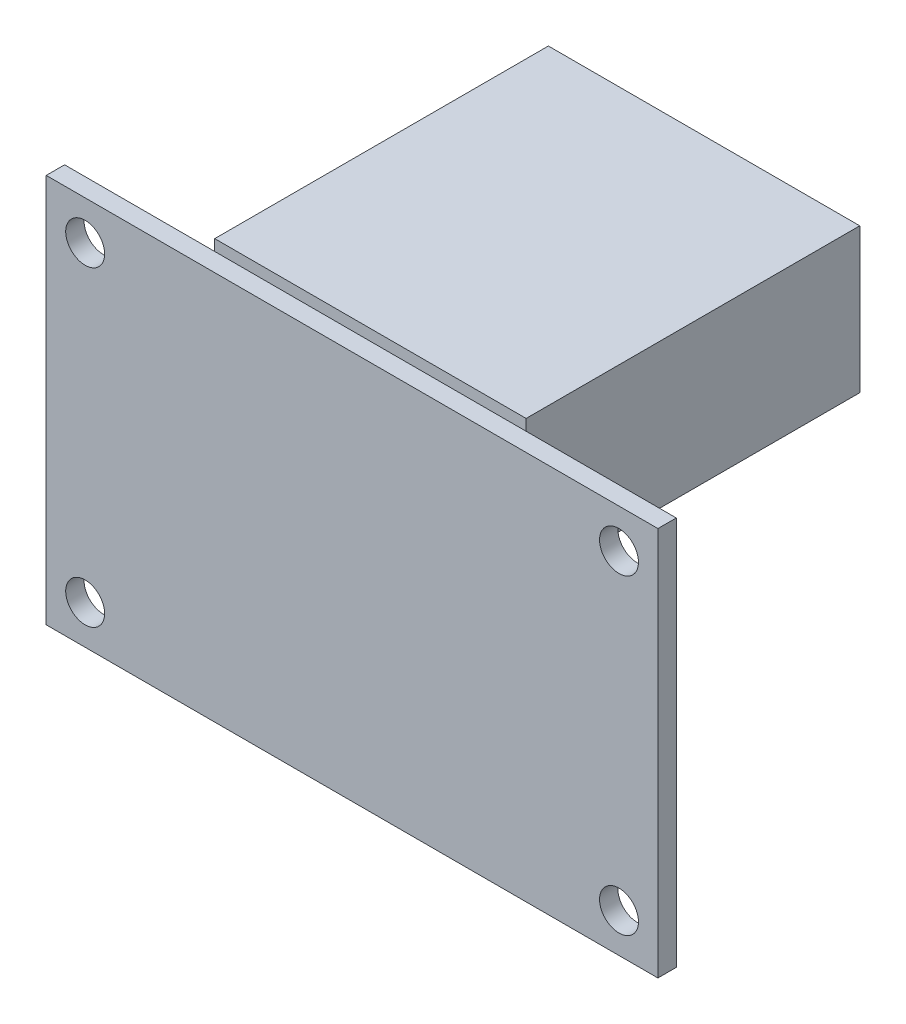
SolidWorks part; units mm, degrees
ref_plane "Plan de face" through (0, 0, 0) normal (0, 0, 1) x (1, 0, 0)
ref_plane "Plan de dessus" through (0, 0, 0) normal (0, 1, 0) x (1, 0, 0)
ref_plane "Plan de droite" through (0, 0, 0) normal (1, 0, 0) x (0, 0, -1)
sketch "Esquisse1" plane through (0, 0, 0) normal (0, 0, 1) x (1, 0, 0)
  line L1 (-27.5152, 31.4406) -> (27.4848, 31.4406)
  line L2 (-27.5152, 31.4406) -> (-27.5152, -3.5594)
  line L3 (-27.5152, -3.5594) -> (27.4848, -3.5594)
  line L4 (27.4848, 31.4406) -> (27.4848, -3.5594)
  circle A0 centre (-24.0152, 27.9406) radius 1.75
  circle A1 centre (-24.0152, -0.0594) radius 1.75
  circle A2 centre (23.9848, 27.9406) radius 1.75
  circle A3 centre (23.9848, -0.0594) radius 1.75
  dimension "D3" = 28
  dimension "D4" = 3.5
  dimension "D1" = 55
  dimension "D2" = 35
  dimension "D5" = 3.5
  dimension "D6" = 28
  dimension "D7" = 48
  dimension "D8" = 3.5
  dimension "D9" = 3.5
  dimension "D10" = 48
extrude "Boss.-Extru.1" add sketch "Esquisse1" along normal blind 1.65
sketch "Esquisse2" plane through (0, 0, 0) normal (0, 0, -1) x (-1, 0, 0)
  line L0 (-27.4848, 31.4406) -> (27.5152, 31.4406) construction
  line L1 (-13.9848, 32.4406) -> (14.0152, 32.4406)
  line L2 (-13.9848, 32.4406) -> (-13.9848, 19.4406)
  line L3 (-13.9848, 19.4406) -> (14.0152, 19.4406)
  line L4 (14.0152, 32.4406) -> (14.0152, 19.4406)
  line L5 (-27.4848, -3.5594) -> (-27.4848, 31.4406) construction
  dimension "D1" = 1
  dimension "D2" = 13
  dimension "D3" = 28
  dimension "D4" = 13.5
extrude "Boss.-Extru.2" add sketch "Esquisse2" along normal blind 30
